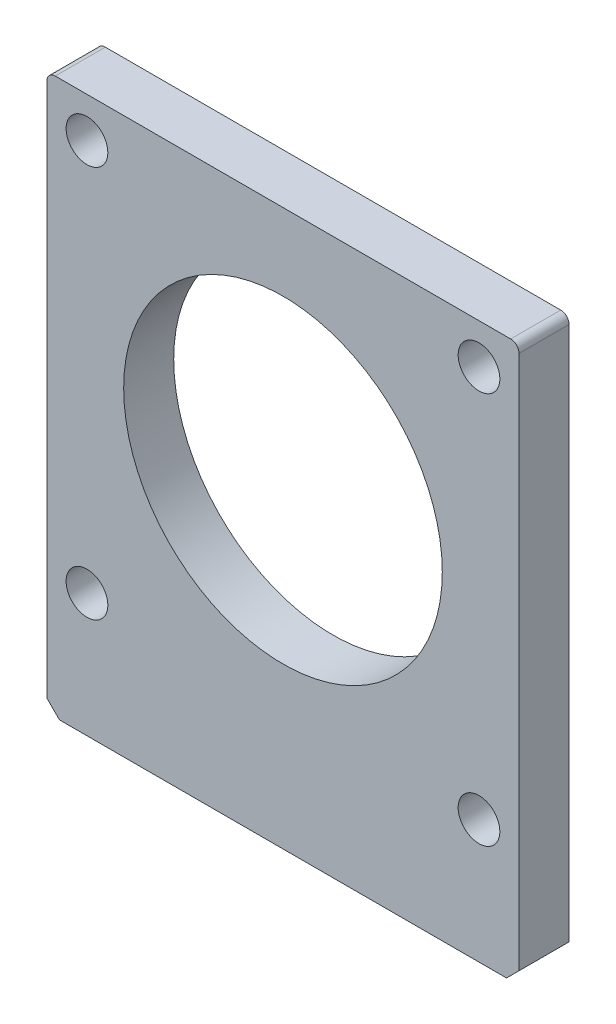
SolidWorks part; units mm, degrees
ref_plane "Front Plane" through (0, 0, 0) normal (0, 0, 1) x (1, 0, 0)
ref_plane "Top Plane" through (0, 0, 0) normal (0, 1, 0) x (1, 0, 0)
ref_plane "Right Plane" through (0, 0, 0) normal (1, 0, 0) x (0, 0, -1)
sketch "Sketch1" plane through (0, 0, 0) normal (0, 0, 1) x (1, 0, 0)
  line L0 (0, -1000) -> (0, 49000) construction
  line L1 (-28.3, 28.3) -> (28.3, 28.3)
  line L2 (-28.3, 28.3) -> (-28.3, -28.3)
  line L3 (-28.3, -28.3) -> (28.3, -28.3)
  line L4 (28.3, 28.3) -> (28.3, -28.3)
  line L5 (-28.3, 28.3) -> (28.3, -28.3) construction
  line L6 (-28.3, -28.3) -> (28.3, 28.3) construction
  line L7 (-1000, 0) -> (49000, 0) construction
  circle A0 centre (0, 0) radius 19.1
  circle A1 centre (-23.5, 23.5) radius 2.5
  circle A2 centre (23.5, 23.5) radius 2.5
  circle A3 centre (23.5, -23.5) radius 2.5
  circle A4 centre (-23.5, -23.5) radius 2.5
  point P0 (0, 0)
extrude "Boss-Extrude1" add sketch "Sketch1" along normal blind 6
sketch "Sketch2" plane through (0, -28.3, 0) normal (0, -1, 0) x (1, 0, 0)
  line L1 (-28.3, 6) -> (28.3, 6)
  line L2 (-28.3, 6) -> (-28.3, 0)
  line L3 (-28.3, 0) -> (28.3, 0)
  line L4 (28.3, 6) -> (28.3, 0)
extrude "Boss-Extrude2" add sketch "Sketch2" along normal blind 10
chamfer "Chamfer1" distance 1.5 angle 45 2 edges at (28.3, -38.3, 3) (-28.3, -38.3, 3)
fillet "Fillet1" radius 1 2 edges at (28.3, 28.3, 3) (-28.3, 28.3, 3)
equation "\"D2@Sketch1\"=\"D1@Sketch1\""
